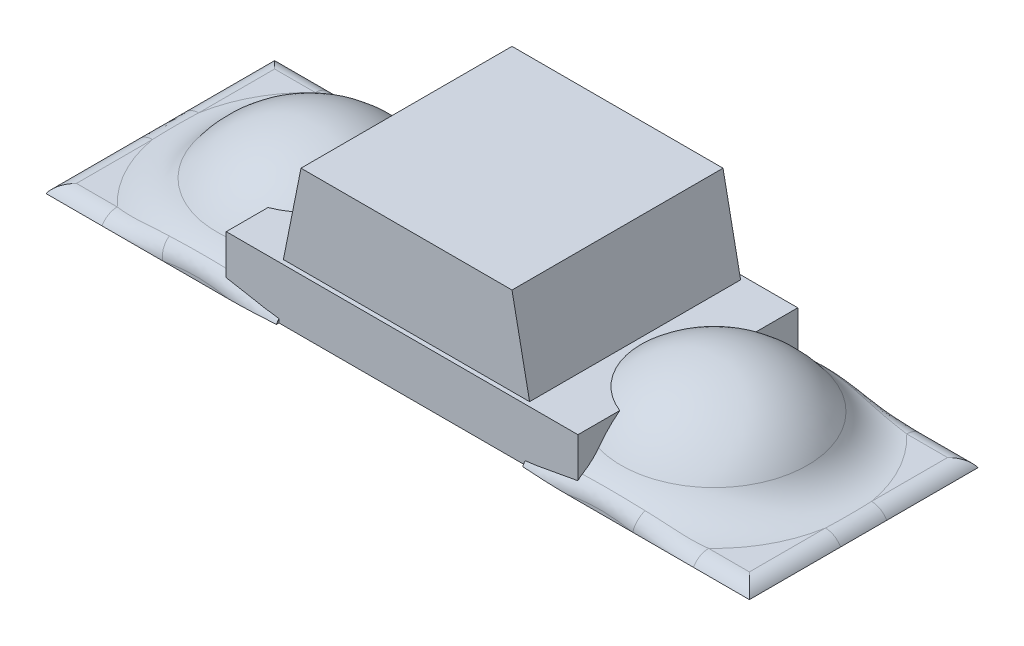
SolidWorks part; units mm, degrees
ref_plane "Front Plane" through (0, 0, 0) normal (0, 0, 1) x (1, 0, 0)
ref_plane "Top Plane" through (0, 0, 0) normal (0, 1, 0) x (1, 0, 0)
ref_plane "Right Plane" through (0, 0, 0) normal (1, 0, 0) x (0, 0, -1)
sketch "Sketch1" plane through (0, 0, 0) normal (0, 1, 0) x (1, 0, 0)
  line L0 (-55, 0) -> (55, 0) construction
  line L1 (-1, 0.625) -> (1, 0.625)
  line L2 (-1, 0.625) -> (-1, 0.25)
  line L3 (-1, -0.625) -> (1, -0.625)
  line L4 (1, 0.625) -> (1, 0.25)
  line L5 (0, -55) -> (0, 55) construction
  line L6 (1, -0.25) -> (1, -0.625)
  line L7 (-1, -0.25) -> (-1, -0.625)
  arc A0 (-1, -0.25) -> (-1, 0.25) centre (-1, 0) ccw
  arc A1 (1, 0.25) -> (1, -0.25) centre (1, 0) ccw
  dimension "D5" = 0.5
  dimension "D1" = 1.25
  dimension "D2" = 0.625
  dimension "D3" = 2
  dimension "D4" = 1
extrude "Boss-Extrude1" add sketch "Sketch1" along normal blind 0.3
sketch "Sketch3" plane through (0, 0, 0) normal (0, 0, 1) x (1, 0, 0)
  line L0 (0, 0.8092) -> (0, -0.2421) construction
  line L1 (-1, 0.3) -> (1, 0.3) construction
  line L2 (0, 0.5) -> (0.25, 0.5)
  line L3 (0, 0.5) -> (0, 0.3)
  line L4 (0, 0.3) -> (0.25, 0.3)
  line L5 (0.25, 0.5) -> (0.25, 0.3)
  dimension "D1" = 0.5
  dimension "D2" = 0.2
revolve "Revolve1" add sketch "Sketch3" angle 360 about L0
sketch "Sketch4" plane through (0, 0, 0) normal (0, 1, 0) x (1, 0, 0)
  line L1 (0, -0.44) -> (0, 0.44) construction
  line L6 (-2, 0.65) -> (-0.7, 0.65)
  line L7 (-2, 0.65) -> (-2, -0.65)
  line L8 (-2, -0.65) -> (-0.7, -0.65)
  line L9 (-0.7, 0.65) -> (-0.7, -0.65)
  line L12 (-0.44, 0) -> (0.44, 0) construction
  dimension "D1" = 0.7
  dimension "D2" = 1.3
  dimension "D5" = 0.65
  dimension "D6" = 1.3
extrude "Boss-Extrude4" add sketch "Sketch4" along normal blind 0.05
sketch "Sketch5" plane through (0, 0, 0) normal (0, 0, 1) x (1, 0, 0)
  line L0 (-1.15, 0.7613) -> (-1.15, -0.3763) construction
  line L1 (0, -0.4704) -> (0, 0.4704) construction
  line L3 (-2, 0.05) -> (-0.7, 0.05) construction
  line L4 (-1.15, 0.45) -> (-1.05, 0.45) construction
  line L5 (-1.15, 0.45) -> (-1.15, 0.05)
  line L6 (-1.15, 0.05) -> (-1.75, 0.05)
  arc A0 (-1.75, 0.05) -> (-1.15, 0.45) centre (-1.15, -0.2) cw
  dimension "D4" = 0.4
  dimension "D1" = 1.15
  dimension "D2" = 0.1
  dimension "D3" = 1.2
revolve "Revolve3" add sketch "Sketch5" angle 360 about L0
fillet "Fillet3" radius 0.3 1 edges at (-1.75, 0.05, 0)
fillet "Fillet4" radius 0.1 5 edges at (-1.4213, 0.0583, -0.65) (-1.7857, 0.05, 0.65) (-2, 0.05, 0) (-1.7857, 0.05, -0.65) (-0.8787, 0.0583, 0.65)
mirror "Mirror3" about plane through (0, 0, 0) normal (1, 0, 0) of "Fillet4", "Fillet3", "Revolve3", "Boss-Extrude4"
sketch "Sketch2" plane through (0, 0, 0) normal (0, 0, 1) x (1, 0, 0)
  line L0 (-0.7, 0.3) -> (0.7, 0.3)
  line L1 (-1, 0.3) -> (1, 0.3) construction
  line L2 (0.7, 0.3) -> (0.6, 0.8)
  line L3 (0.6, 0.8) -> (-0.6, 0.8)
  line L4 (-0.6, 0.8) -> (-0.7, 0.3)
  line L5 (0, -0.4704) -> (0, 0.4704) construction
  line L6 (0, 0.8) -> (0, 0.3) construction
  dimension "D1" = 1.2
  dimension "D2" = 0.5
  dimension "D3" = 1.4
  dimension "D4" = 0.7
extrude "Boss-Extrude5" add sketch "Sketch2" along normal mid plane 1.2 separate body
